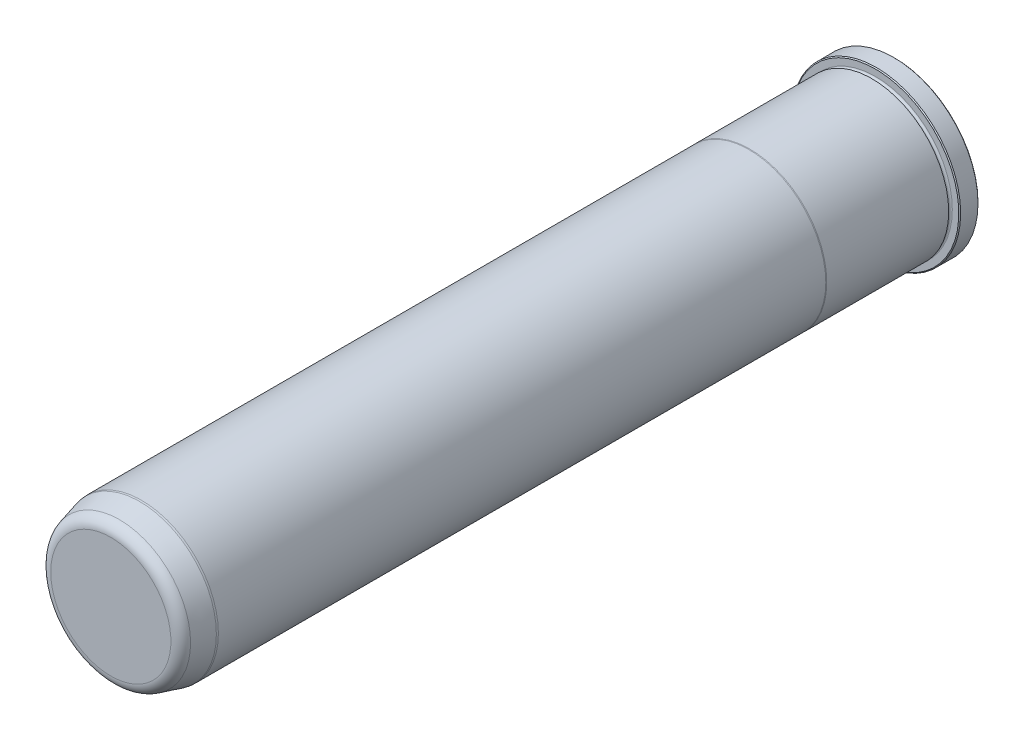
SolidWorks part; units mm, degrees
ref_plane "Front Plane" through (0, 0, 0) normal (0, 0, 1) x (1, 0, 0)
ref_plane "Top Plane" through (0, 0, 0) normal (0, 1, 0) x (1, 0, 0)
ref_plane "Right Plane" through (0, 0, 0) normal (1, 0, 0) x (0, 0, -1)
sketch "Sketch1" plane through (0, 0, 0) normal (1, 0, 0) x (0, 0, -1)
  line L0 (0, 0) -> (0, 34.798)
  line L1 (0, 34.798) -> (-7.9248, 34.798)
  line L2 (-7.9248, 34.798) -> (-7.9248, 31.7373)
  line L3 (-7.9248, 30.9753) -> (-9.4488, 30.9753) construction
  line L4 (-9.4488, 31.7373) -> (-9.4488, 31.7627)
  line L5 (-9.4488, 31.7627) -> (-59.8348, 31.7627)
  line L6 (-59.8348, 31.7627) -> (-60.198, 31.7373)
  line L7 (-60.198, 31.7373) -> (-311.15, 31.7373)
  line L9 (-323.85, 28.4719) -> (-323.85, 0)
  line L10 (-323.85, 0) -> (0, 0)
  line L11 (0, 0) -> (13.6287, 0) construction
  line L12 (-311.15, 31.7373) -> (-311.912, 31.6706)
  line L13 (-311.912, 31.6706) -> (-323.85, 28.4719)
  arc A0 (-9.4488, 31.7373) -> (-7.9248, 31.7373) centre (-8.6868, 31.7373) ccw
  dimension "D14" = 1.524
  dimension "D1" = 7.9248
  dimension "D2" = 1.524
  dimension "D3" = 69.596
  dimension "D4" = 63.5254
  dimension "D5" = 60.198
  dimension "D6" = 323.85
  dimension "D7" = 0.7874
  dimension "D8" = 4
  dimension "D9" = 63.4746
  dimension "D10" = 5
  dimension "D11" = 15
  dimension "D12" = 0.762
  dimension "D13" = 12.7
revolve "Revolve1" add sketch "Sketch1" angle 360 about L11
fillet "Fillet6" radius 4.7625 1 edges at (28.4719, 0, 323.85)
chamfer "Chamfer1" distance 0.381 angle 45 2 edges at (34.798, 0, 0) (34.798, 0, 7.9248)
